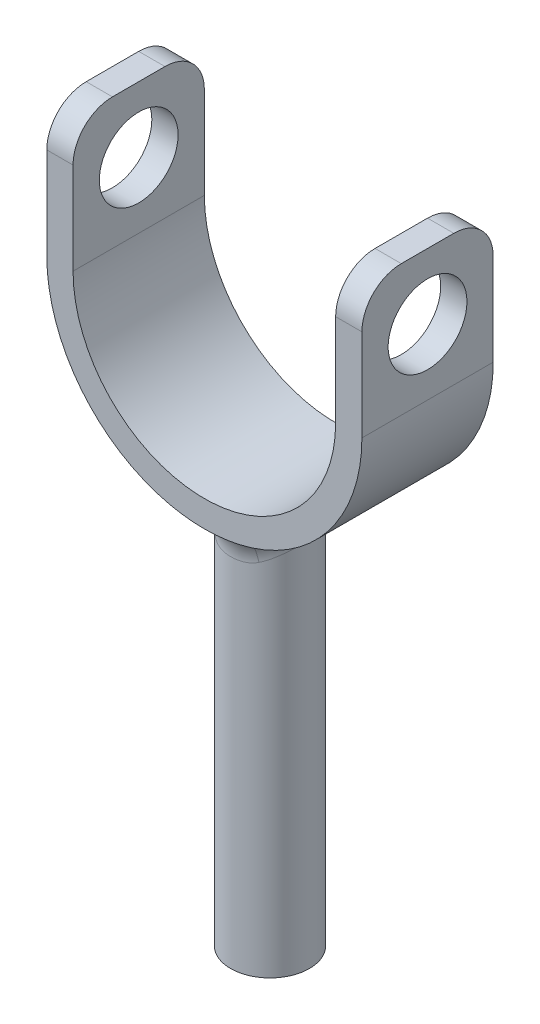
SolidWorks part; units mm, degrees
ref_plane "Alzado" through (0, 0, 0) normal (0, 0, 1) x (1, 0, 0)
ref_plane "Planta" through (0, 0, 0) normal (0, 1, 0) x (1, 0, 0)
ref_plane "Vista lateral" through (0, 0, 0) normal (1, 0, 0) x (0, 0, -1)
sketch "Croquis1" plane through (0, 0, 0) normal (0, 0, 1) x (1, 0, 0)
  line L0 (-60, 110) -> (-60, 60)
  line L1 (0, 0) -> (-216.3462, 0) construction
  line L2 (0, 0) -> (0, 239.4231) construction
  line L3 (-50, 110) -> (-50, 60)
  line L4 (-60, 110) -> (-50, 110)
  line L5 (0, 0) -> (0, 10) construction
  line L6 (60, 110) -> (50, 110)
  line L7 (50, 110) -> (50, 60)
  line L8 (60, 110) -> (60, 60)
  arc A0 (-60, 60) -> (0, 0) centre (0, 60) ccw
  arc A1 (-50, 60) -> (0, 10) centre (0, 60) ccw
  arc A2 (60, 60) -> (0, 0) centre (0, 60) cw
  arc A3 (50, 60) -> (0, 10) centre (0, 60) cw
  dimension "D1" = 50
  dimension "D2" = 60
  dimension "D3" = 10
extrude "Saliente-Extruir1" add sketch "Croquis1" along normal mid plane 50 contours L7 A3 A1 L3 L4 L0 A0 A2 L8 L6
sketch "Croquis3" plane through (0, 0, 0) normal (0, 0, 1) x (1, 0, 0)
  line L0 (0, 1.9052) -> (0, -150)
  line L1 (0, -150) -> (15, -150)
  line L2 (15, -150) -> (15, 1.9052)
  line L3 (15, 1.9052) -> (0, 1.9052)
  arc A0 (-60, 60) -> (60, 60) centre (0, 60) ccw construction
  point P3 (0, 0)
  point P7 (0, 0)
  point P8 (0, 0)
  dimension "D1" = 15
  dimension "D2" = 210
revolve "Revolución2" add sketch "Croquis3" angle 360 about L0
fillet "Redondeo1" radius 15 1 edges at (14.7095, 1.831, 2.9378)
fillet "Redondeo2" radius 15 4 edges at (-55, 110, -25) (-55, 110, 25) (55, 110, -25) (55, 110, 25)
hole_wizard "Taladro1" positions "Croquis6" profile "Croquis7" legacy
sketch "Croquis6" plane through (60, 0, 0) normal (1, 0, 0) x (0, 0, -1)
  line L0 (-10, 110) -> (10, 110) construction
  point P0 (0, 85)
  dimension "D1" = 25
sketch "Croquis7" plane through (60, 85, 0) normal (0, 1, 0) x (0, 0, -1)
  line L0 (0, 0) -> (0, 120)
  line L1 (0, 120) -> (15, 120)
  line L2 (15, 120) -> (15, 0)
  line L3 (15, 0) -> (0, 0)
  line L4 (0, 110) -> (0, -10) construction
  dimension "Diámetro" = 30
  dimension "Profundidad" = 120
